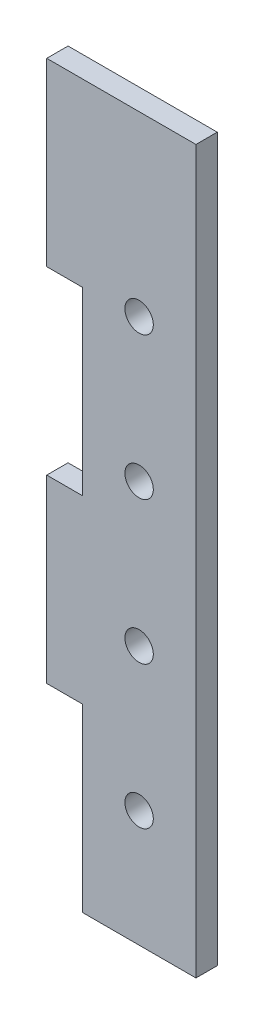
SolidWorks part; units mm, degrees
ref_plane "Front Plane" through (0, 0, 0) normal (0, 0, 1) x (1, 0, 0)
ref_plane "Top Plane" through (0, 0, 0) normal (0, 1, 0) x (1, 0, 0)
ref_plane "Right Plane" through (0, 0, 0) normal (1, 0, 0) x (0, 0, -1)
sketch "Sketch1" plane through (0, 0, 0) normal (0, 0, 1) x (1, 0, 0)
  line L0 (0, 50.8) -> (0, 25.8) construction
  line L1 (-8, 50.8) -> (8, 50.8)
  line L2 (-8, 50.8) -> (-8, -50.8)
  line L3 (-8, -50.8) -> (8, -50.8)
  line L4 (8, 50.8) -> (8, -50.8)
  line L5 (-8, 50.8) -> (8, -50.8) construction
  line L6 (-8, -50.8) -> (8, 50.8) construction
  circle A0 centre (0, 25.8) radius 2
  circle A1 centre (0, 5.734) radius 2
  circle A2 centre (0, -14.332) radius 2
  circle A3 centre (0, -34.398) radius 2
  point P0 (0, 0)
  dimension "D4" = 4
  dimension "D1" = 16
  dimension "D2" = 101.6
  dimension "D3" = 25
  dimension "D5" = 4
extrude "Boss-Extrude1" add sketch "Sketch1" along normal blind 3
sketch "Sketch3" plane through (-8, 0, 0) normal (-1, 0, 0) x (0, 0, 1)
  line L0 (3, 50.8) -> (3, -50.8) construction
  line L1 (0, 50.8) -> (3, 50.8)
  line L2 (0, 50.8) -> (0, 25.4)
  line L3 (0, 25.4) -> (3, 25.4)
  line L4 (3, 50.8) -> (3, 25.4)
  line L5 (3, 25.4) -> (3, 0) construction
  line L6 (0, 50.8) -> (0, -50.8) construction
  line L7 (3, 0) -> (0, 0)
  line L8 (3, 0) -> (3, -25.4)
  line L9 (3, -25.4) -> (0, -25.4)
  line L10 (0, 0) -> (0, -25.4)
  line L11 (3, -50.8) -> (3, -25.4) construction
  dimension "D1" = 25.4
  dimension "D2" = 25.4
  dimension "D3" = 25.4
extrude "Boss-Extrude3" add sketch "Sketch3" along normal blind 5
sketch "Sketch6" plane through (0, 25.4, 0) normal (0, -1, 0) x (1, 0, 0)
  line L0 (-13, 1.5) -> (-8, 1.5) construction
  line L1 (-13, 0) -> (-13, 3) construction
  line L2 (-8, 0) -> (-8, 3) construction
  circle A0 centre (-10.5, 1.5) radius 1
  dimension "D1" = 2
extrude "Cut-Extrude3" cut sketch "Sketch6" against normal blind 20
sketch "Sketch7" plane through (0, -25.4, 0) normal (0, -1, 0) x (1, 0, 0)
  line L0 (-13, 1.5) -> (-8, 1.5) construction
  line L1 (-13, 0) -> (-13, 3) construction
  line L2 (-8, 0) -> (-8, 3) construction
  circle A0 centre (-10.5, 1.5) radius 1
  dimension "D1" = 2
extrude "Cut-Extrude4" cut sketch "Sketch7" against normal blind 20
